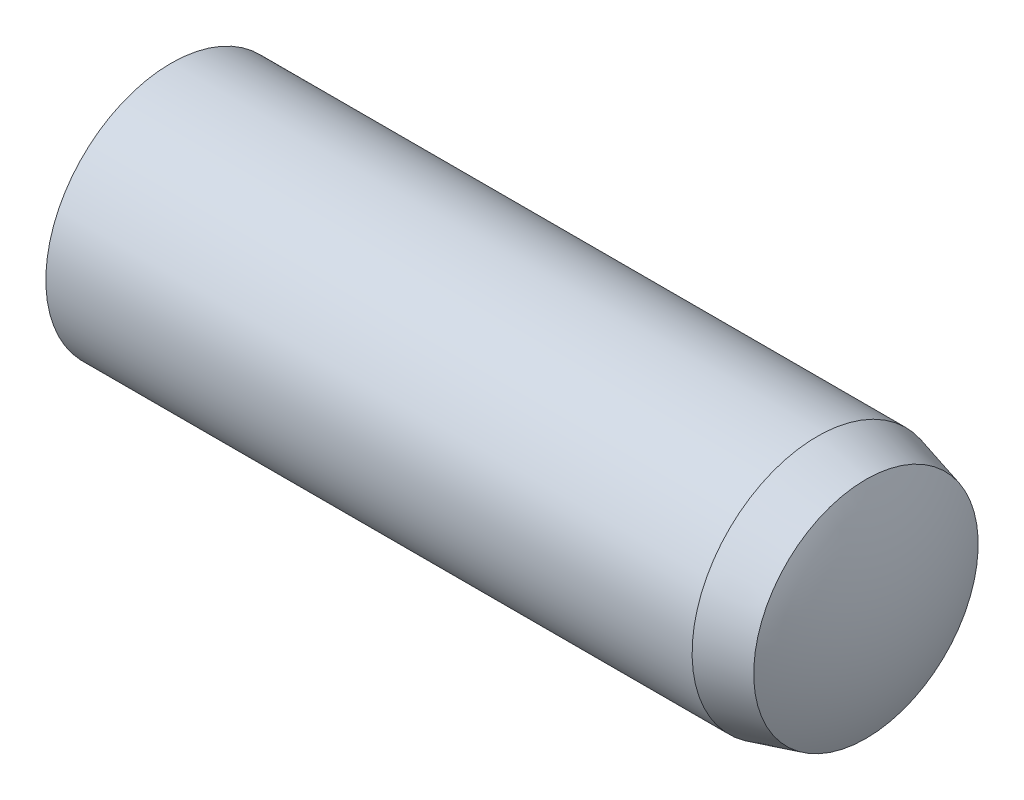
SolidWorks part; units mm, degrees
ref_plane "Plane1" through (0, 0, 0) normal (0, 0, 1) x (1, 0, 0)
ref_plane "Plane2" through (0, 0, 0) normal (0, 1, 0) x (1, 0, 0)
ref_plane "Plane3" through (0, 0, 0) normal (1, 0, 0) x (0, 0, -1)
sketch "BodySke" plane through (0, 0, 0) normal (0, 0, 1) x (1, 0, 0)
  line L0 (0, 0) -> (40.9091, 0) construction
  line L1 (27, 5) -> (28.9403, 4.4801)
  line L2 (1.2, 5) -> (27, 5)
  line L4 (0, 0) -> (30, 0)
  arc A0 (1.2, 5) -> (0, 0) centre (11.0167, 0) ccw
  arc A1 (30, 0) -> (28.9403, 4.4801) centre (20, 0) ccw
  dimension "TipRad" = 10
  dimension "D1" = 15
  dimension "Diameter" = 10
  dimension "Length" = 30
  dimension "Crown_ht" = 1.2
  dimension "Chamfer_len" = 3
revolve "Body" add sketch "BodySke" angle 360 about L0
equation "\"TipRad@BodySke\" = \"Diameter@BodySke\""
